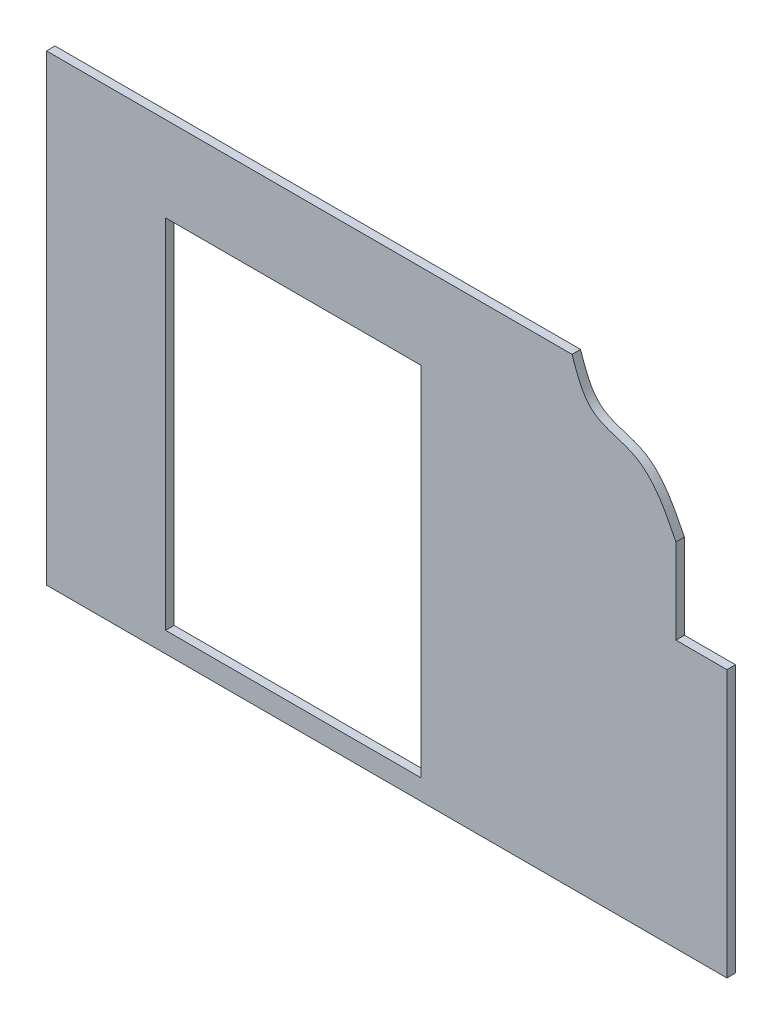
SolidWorks part; units mm, degrees
ref_plane "Face" through (0, 0, 0) normal (0, 0, 1) x (1, 0, 0)
ref_plane "Dessus" through (0, 0, 0) normal (0, 1, 0) x (1, 0, 0)
ref_plane "Droite" through (0, 0, 0) normal (1, 0, 0) x (0, 0, -1)
sketch "Esquisse1" plane through (0, 0, 0) normal (0, 0, 1) x (1, 0, 0)
  line L0 (371.4894, 157) -> (371.4894, 0)
  line L1 (-28.5106, 0) -> (371.4894, 0)
  line L2 (-28.5106, 0) -> (-28.5106, 272)
  line L3 (-28.5106, 272) -> (280.4069, 272)
  line L4 (341.4894, 207) -> (341.4894, 157)
  line L5 (41.4894, 12) -> (191.4894, 12)
  line L6 (41.4894, 12) -> (41.4894, 222)
  line L7 (41.4894, 222) -> (191.4894, 222)
  line L8 (191.4894, 12) -> (191.4894, 222)
  line L10 (341.4894, 157) -> (371.4894, 157)
  spline S0 degree 3 poles (341.4894, 207) (335.0212, 220.0046) (324.5654, 241.0266) (289.6349, 245.054) (283.5523, 262.8154) (280.4069, 272) knots 0 0 0 0 0.439235 0.710022 1 1 1 1
  dimension "D1" = 70
  dimension "D2" = 210
  dimension "D3" = 150
  dimension "D4" = 272
  dimension "D5" = 222
  dimension "D6" = 157
  dimension "D7" = 400
  dimension "D8" = 150
  dimension "D9" = 50
extrude "Extrusion1" add sketch "Esquisse1" along normal blind 5
